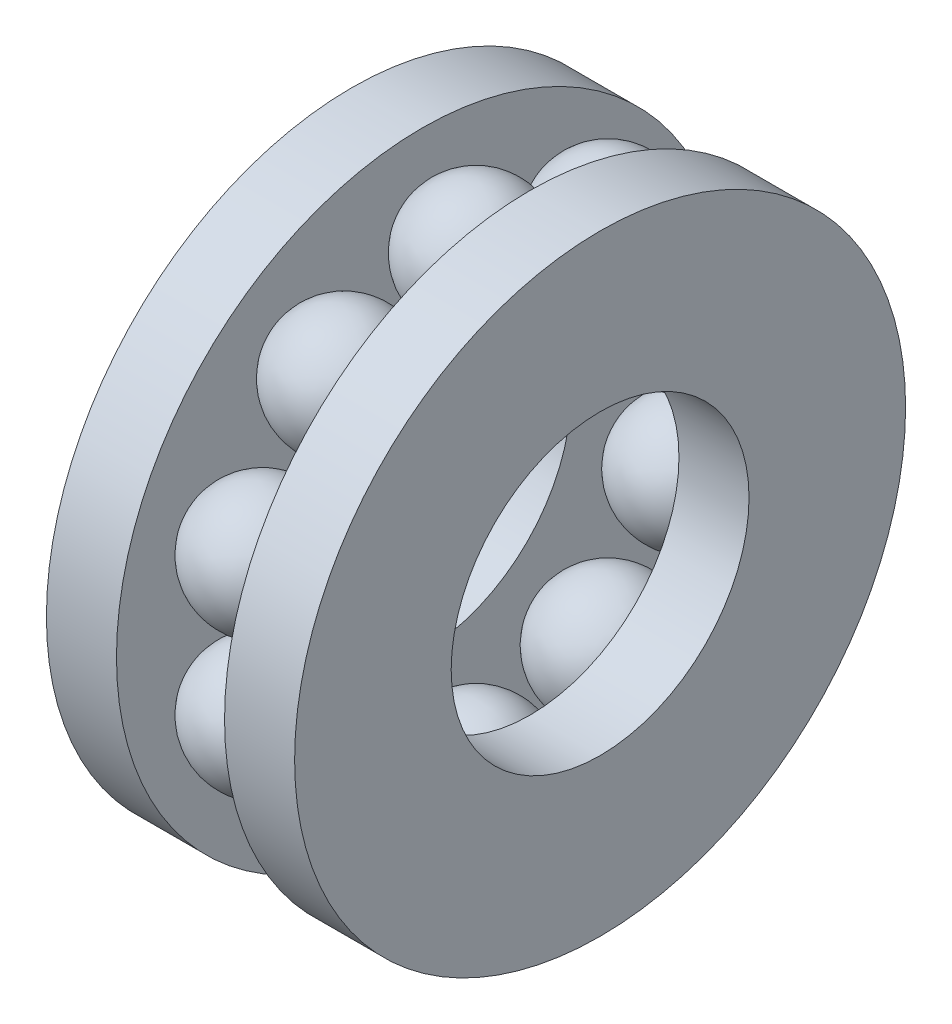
SolidWorks part; units mm, degrees
ref_plane "Front Plane" through (0, 0, 0) normal (0, 0, 1) x (1, 0, 0)
ref_plane "Top Plane" through (0, 0, 0) normal (0, 1, 0) x (1, 0, 0)
ref_plane "Right Plane" through (0, 0, 0) normal (1, 0, 0) x (0, 0, -1)
sketch "Sketch1" plane through (0, 0, 0) normal (0, 0, 1) x (1, 0, 0)
  line L0 (-18.35, 39) -> (0, 39)
  line L1 (-46.65, 39) -> (-46.65, 80)
  line L2 (-18.35, 39) -> (-18.35, 80)
  line L3 (-18.35, 80) -> (0, 80)
  line L4 (0, 39) -> (0, 80)
  line L5 (0, 0) -> (-65, 0) construction
  line L6 (-46.65, 80) -> (-65, 80)
  line L7 (-65, 80) -> (-65, 39)
  line L8 (-65, 39) -> (-46.65, 39)
  dimension "D4" = 28.3
  dimension "D1" = 80
  dimension "D3" = 39
  dimension "D7" = 65
revolve "Revolve1" add sketch "Sketch1" angle 360 about L5
sketch "Sketch2" plane through (0, 0, 0) normal (0, 0, 1) x (1, 0, 0)
  line L0 (-18.35, 0) -> (-46.65, 0) construction
  line L1 (-18.35, 80) -> (-18.35, -80) construction
  line L2 (-46.65, -80) -> (-46.65, 80) construction
  line L3 (-32.5, 0) -> (-32.5, 58.75) construction
  line L4 (-16.25, 58.75) -> (-48.75, 58.75)
  line L5 (-16.25, 58.75) -> (-48.75, 58.75) construction
  arc A0 (-16.25, 58.75) -> (-48.75, 58.75) centre (-32.5, 58.75) ccw
  dimension "D1" = 32.5
  dimension "D2" = 58.75
revolve "Revolve3" add sketch "Sketch2" angle 360 about L5
pattern_circular "CirPattern1" count 10 over 360 about axis through (0, 0, 0) along (1, 0, 0) of "Revolve3"
